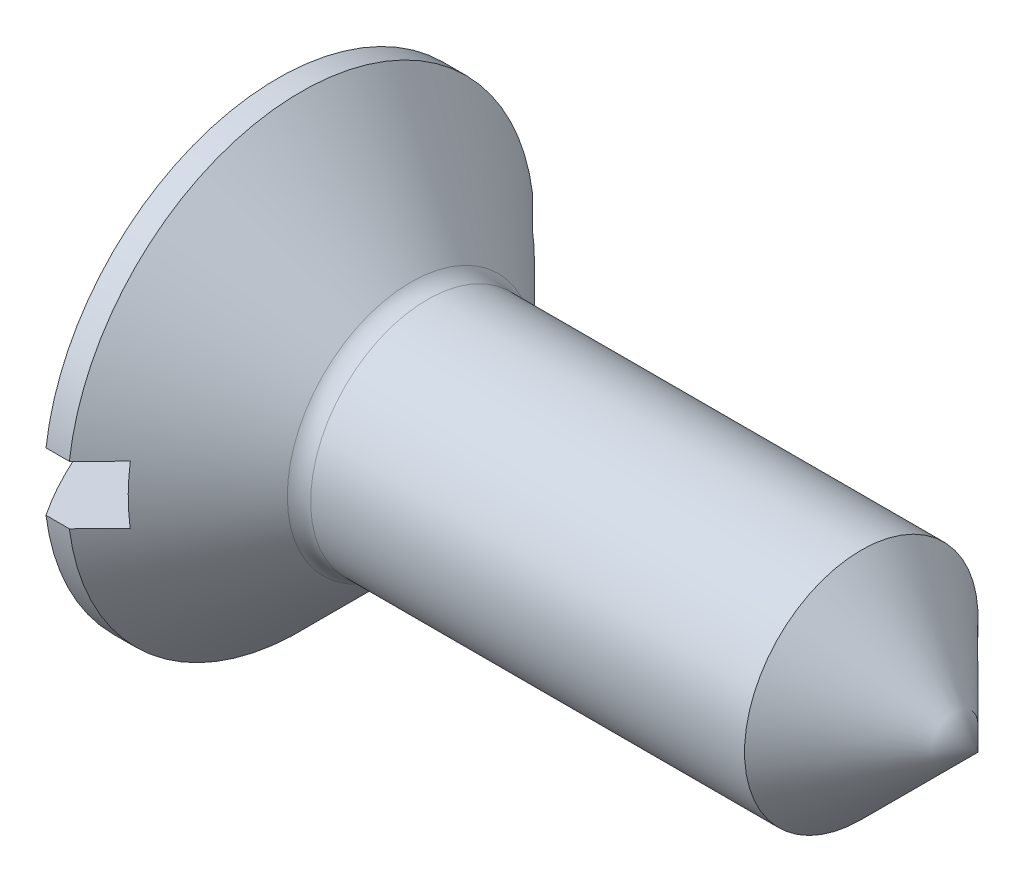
SolidWorks part; units mm, degrees
ref_plane "Front" through (0, 0, 0) normal (0, 0, 1) x (1, 0, 0)
ref_plane "Top" through (0, 0, 0) normal (0, 1, 0) x (1, 0, 0)
ref_plane "Right" through (0, 0, 0) normal (1, 0, 0) x (0, 0, -1)
other "Configuration Table"
sketch "Sketch2" plane through (1.6915, 0, 0.5085) normal (0, 1, 0) x (0, 0, -1)
  line L0 (0.5085, -4.3085) -> (0.5085, 2.1079) construction
  line L2 (0.5085, 0.4915) -> (1.5085, 0.4915)
  line L4 (1.5085, 0.4915) -> (2.7085, 1.6915)
  line L5 (2.7085, 1.6915) -> (0.5085, 1.6915)
  line L6 (0.5085, 0.4915) -> (0.5085, 1.6915)
revolve "BaseHead" add sketch "Sketch2" angle 360 about L0
sketch "Sketch1" plane through (1.2, 0.2435, -0.4482) normal (1, 0, 0) x (0, 0, -1)
  circle A0 centre (-0.4482, -0.2435) radius 1
extrude "BaseBody" add sketch "Sketch1" along normal blind 4.8
sketch "Sketch3" plane through (0, 0, 0) normal (1, 0, 0) x (0, 0, -1)
  circle A0 centre (0, 0) radius 2
  circle A1 centre (0, 0) radius 2.2 construction
  circle A2 centre (0, 0) radius 2.2
  dimension "dk" = 4
extrude "Cut-Extrude1" cut sketch "Sketch3" along normal through all
sketch "Sketch4" plane through (2.4858, 0, -0.4858) normal (0, 1, 0) x (0, 0, -1)
  line L0 (-0.4858, 0) -> (-0.4858, 2.9717) construction
  line L2 (-0.2358, 3.0858) -> (-0.2358, 2.4858)
  line L3 (1.5142, 2.4858) -> (-2.4858, 2.4858) construction
  line L4 (1.5142, 2.4858) -> (-0.2358, 2.4858)
  arc A0 (-0.2358, 3.0858) -> (1.5142, 2.4858) centre (-0.4892, -0.5052) cw
  dimension "rf" = 3.6
  dimension "n" = 0.5
  dimension "f" = 0.6
revolve "BaseTop" add sketch "Sketch4" angle 360 about L0
sketch "Sketch5" plane through (1.6783, 1.6783, 0) normal (0, 0, 1) x (0, 1, 0)
  line L1 (-1.4283, 1.6783) -> (-1.4283, 2.2783) construction
  line L2 (-1.6783, 0) -> (-1.6783, 3.3566) construction
  line L4 (-1.4283, 1.2183) -> (-1.9283, 1.2183)
  line L5 (-1.4283, 1.2183) -> (-1.4283, 2.2783)
  line L6 (-1.9283, 2.2783) -> (-1.9283, 1.2183)
  line L7 (-1.4283, 2.2783) -> (-1.9283, 2.2783)
  point P9 (-1.6783, 1.2183)
  dimension "t" = 1.06
extrude "Slot" cut sketch "Sketch5" against normal through all and the other way through all
fillet "Fillet1" radius 0.2 1 edges at (1.2, 0, -1)
sketch "Sketch6" plane through (12.7984, -7.2016, 0) normal (0, 0, 1) x (0, 1, 0)
  line L0 (7.2016, -3.8376) -> (7.2016, -8.4033) construction
  line L2 (7.2016, 6.0537) -> (27.2016, 6.0537)
  line L3 (27.2016, 6.0537) -> (27.2016, 26.7984)
  line L4 (27.2016, 26.7984) -> (7.2016, 6.7984)
  line L5 (7.2016, 6.7984) -> (7.2016, 6.0537)
  line L7 (6.2016, 6.7984) -> (8.2016, 6.7984) construction
  dimension "D1" = 45
  dimension "D2" = 20
  dimension "D3" = 0.7447
revolve "Cut-Revolve1" cut sketch "Sketch6" angle 360 about L0
sketch "Sketch8" plane through (0, 0, 0) normal (0, 0, 1) x (1, 0, 0)
  line L0 (2, 1.2) -> (2.25, 1.2)
  line L1 (2.25, 1.2) -> (2.25, 1)
  line L2 (2.25, 1) -> (2.125, 0.7835)
  line L3 (2, 1) -> (2.125, 0.7835)
  line L4 (2, 1.2) -> (2, 1)
  line L5 (21.5487, 0) -> (0, 0) construction
  line L6 (2, 1) -> (2.25, 1) construction
  line L7 (2.125, 1) -> (2.125, 0.7835) construction
  line L9 (5, 1) -> (1.2828, 1) construction
  point P6 (2.125, 1.2)
revolve "Cut-Revolve10" [suppressed] cut sketch "Sketch8" angle 360 about L5
pattern_linear "LPattern10" [suppressed] count 8 spacing 0.5
equation "\"D1@Sketch2\" = \"d@Sketch1\" / 2"
equation "\"D2@Sketch8\" = (  \"d@Sketch1\" - \"dm@ThreadCosmetic1\" )  / 2"
equation "\"D3@Sketch8\" = \"D1@ThreadCosmetic1\" + \"d@Sketch1\" / 2"
equation "\"D3@LPattern10\" = \"D2@Sketch8\" * 2"
equation "\"D1@LPattern10\" = \"D3@Sketch8\" / \"D3@LPattern10\""
equation "\"l@BaseBody\" = \"l@Sketch2\" - \"k@Sketch2\""
